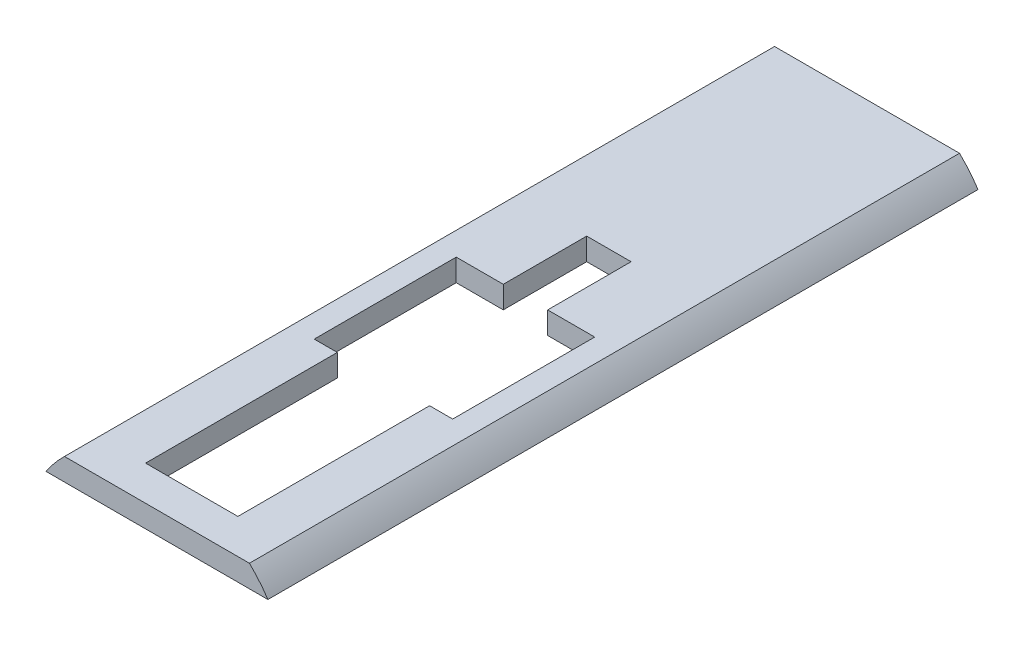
SolidWorks part; units mm, degrees
ref_plane "Front Plane" through (0, 0, 0) normal (0, 0, 1) x (1, 0, 0)
ref_plane "Top Plane" through (0, 0, 0) normal (0, 1, 0) x (1, 0, 0)
ref_plane "Right Plane" through (0, 0, 0) normal (1, 0, 0) x (0, 0, -1)
sketch "Sketch1" plane through (0, 0, 0) normal (0, 0, 1) x (1, 0, 0)
  circle A0 centre (0, 0) radius 19.05
  dimension "D1" = 38.1
extrude "Extrude1" add sketch "Sketch1" along normal blind 101.6
sketch "Sketch2" plane through (0, 0, 101.6) normal (0, 0, 1) x (1, 0, 0)
  line L0 (-13.2313, 13.7053) -> (13.2313, 13.7053)
  line L1 (-15.875, 10.5303) -> (15.875, 10.5303)
  circle A0 centre (0, 0) radius 19.05 construction
  arc A1 (-15.875, 10.5303) -> (15.875, 10.5303) centre (0, 0) ccw
  arc A2 (-13.2313, 13.7053) -> (13.2313, 13.7053) centre (0, 0) cw
  dimension "D1" = 3.175
  dimension "D2" = 31.75
extrude "Cut-Extrude1" cut sketch "Sketch2" against normal through all
sketch "Sketch3" plane through (0, 13.7053, 0) normal (0, 1, 0) x (-1, 0, 0)
  line L0 (0, 101.6) -> (0, 0) construction
  line L1 (13.2313, 101.6) -> (-13.2313, 101.6) construction
  line L2 (13.2313, 0) -> (-13.2313, 0) construction
  line L3 (6.604, 96.6251) -> (-6.604, 96.6251)
  line L4 (-6.604, 96.6251) -> (-6.604, 69.1931)
  line L5 (-6.604, 69.1931) -> (-9.906, 69.1931)
  line L6 (-9.906, 69.1931) -> (-9.906, 48.8731)
  line L7 (9.906, 48.8731) -> (3.175, 48.8731)
  line L8 (9.906, 69.1931) -> (9.906, 48.8731)
  line L9 (6.604, 69.1931) -> (9.906, 69.1931)
  line L10 (6.604, 96.6251) -> (6.604, 69.1931)
  line L11 (3.175, 48.8731) -> (3.175, 36.9351)
  line L12 (3.175, 36.9351) -> (-3.175, 36.9351)
  line L13 (-3.175, 48.8731) -> (-3.175, 36.9351)
  line L14 (-3.175, 48.8731) -> (-9.906, 48.8731)
  point P13 (0, 36.9351)
  point P16 (0, 96.6251)
  point P20 (0, 36.9351)
  dimension "D1" = 13.208
  dimension "D2" = 19.812
  dimension "D3" = 11.938
  dimension "D4" = 59.69
  dimension "D5" = 6.35
  dimension "D6" = 20.32
extrude "Cut-Extrude2" cut sketch "Sketch3" against normal through all
